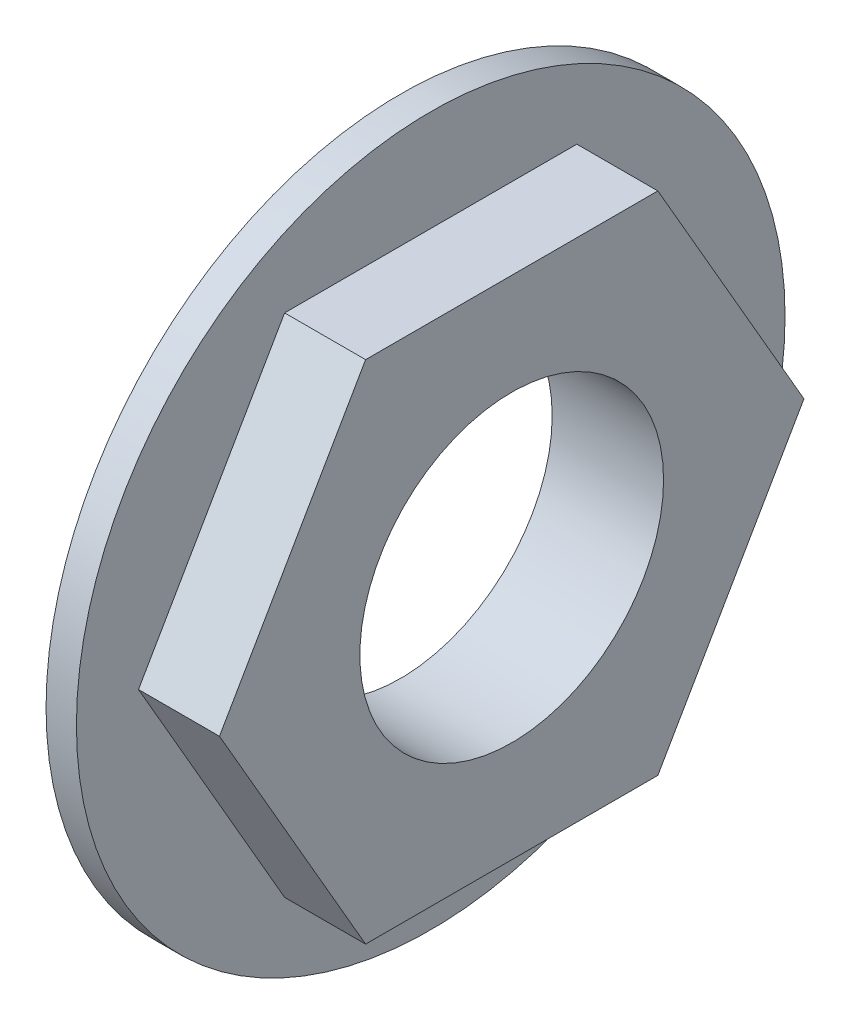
SolidWorks part; units mm, degrees
ref_plane "Front Plane" through (0, 0, 0) normal (0, 0, 1) x (1, 0, 0)
ref_plane "Top Plane" through (0, 0, 0) normal (0, 1, 0) x (1, 0, 0)
ref_plane "Right Plane" through (0, 0, 0) normal (1, 0, 0) x (0, 0, -1)
sketch "Sketch2" plane through (0, 0, 0) normal (1, 0, 0) x (0, 0, -1)
  circle A0 centre (0, 0) radius 22.225
  dimension "D1" = 44.45
extrude "Boss-Extrude1" add sketch "Sketch2" along normal blind 1.905
sketch "Sketch4" plane through (1.905, 0, 0) normal (1, 0, 0) x (0, 0, -1)
  line L1 (18.3309, 0) -> (9.1654, 15.875)
  line L2 (9.1654, 15.875) -> (-9.1654, 15.875)
  line L3 (-9.1654, 15.875) -> (-18.3309, 0)
  line L4 (-18.3309, 0) -> (-9.1654, -15.875)
  line L5 (-9.1654, -15.875) -> (9.1654, -15.875)
  line L6 (9.1654, -15.875) -> (18.3309, 0)
  circle A0 centre (0, 0) radius 15.875 construction
  dimension "D1" = 31.75
extrude "Boss-Extrude2" add sketch "Sketch4" along normal blind 5.08
sketch "Sketch3" plane through (1.905, 0, 0) normal (1, 0, 0) x (0, 0, -1)
  circle A0 centre (0, 0) radius 9.525
  dimension "D1" = 19.05
extrude "Cut-Extrude1" cut sketch "Sketch3" against normal mid plane 12.7
